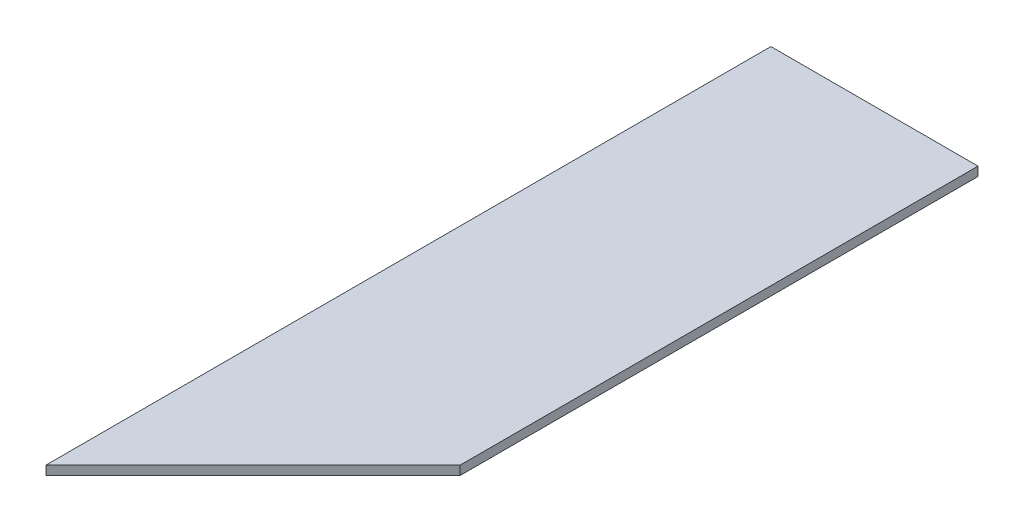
SolidWorks part; units mm, degrees
ref_plane "Front Plane" through (0, 0, 0) normal (0, 0, 1) x (1, 0, 0)
ref_plane "Top Plane" through (0, 0, 0) normal (0, 1, 0) x (1, 0, 0)
ref_plane "Right Plane" through (0, 0, 0) normal (1, 0, 0) x (0, 0, -1)
body saved out of another part "Stock-part 1-1"
